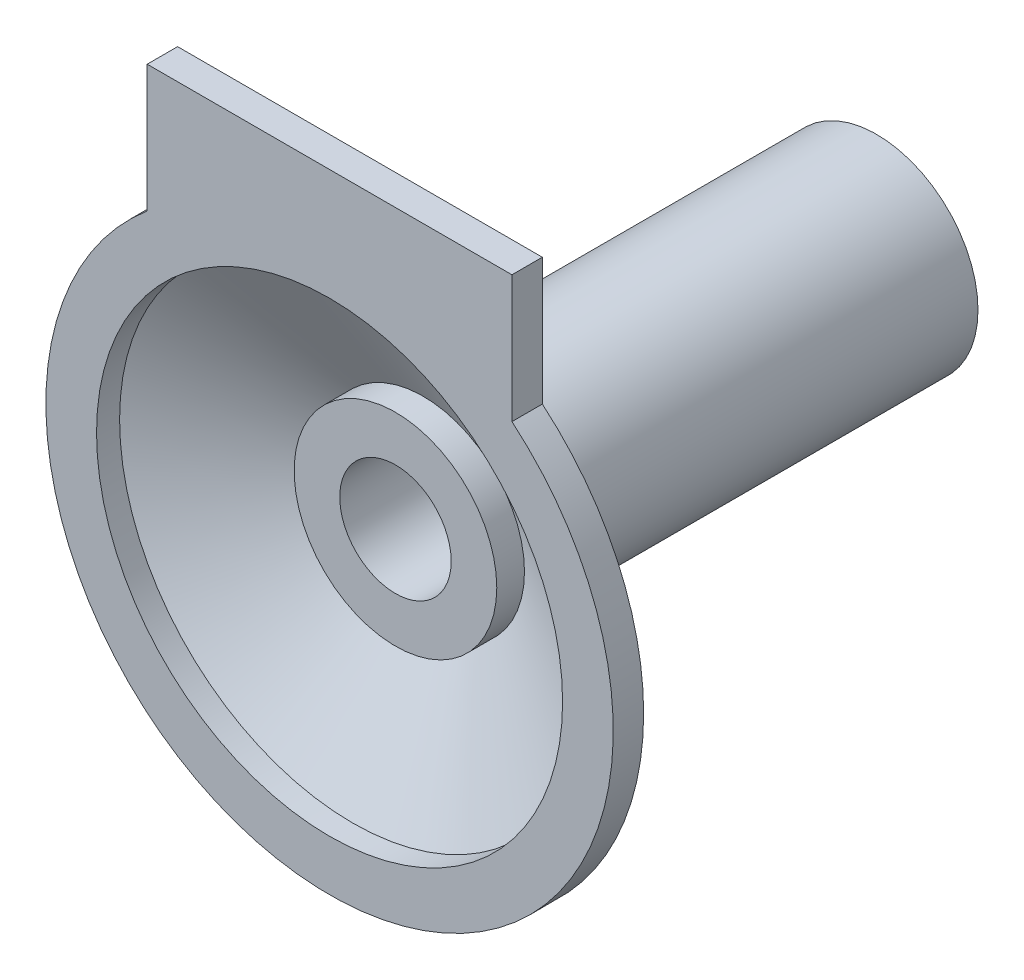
SolidWorks part; units mm, degrees
ref_plane "Front" through (0, 0, 0) normal (0, 0, 1) x (1, 0, 0)
ref_plane "Top" through (0, 0, 0) normal (0, 1, 0) x (1, 0, 0)
ref_plane "Right" through (0, 0, 0) normal (1, 0, 0) x (0, 0, -1)
sketch "Sketch1" plane through (0, 0, 0) normal (1, 0, 0) x (0, 0, -1)
  line L0 (0, 0) -> (89.8884, 0) construction
  line L1 (0, -73.025) -> (0, -88.9)
  line L2 (0, -88.9) -> (9.525, -88.9)
  line L3 (9.525, -88.9) -> (40.1411, -31.75)
  line L4 (40.1411, -31.75) -> (171.45, -31.75)
  line L5 (171.45, -31.75) -> (171.45, -17.4625)
  line L6 (171.45, -17.4625) -> (120.65, -17.4625)
  line L7 (120.65, -17.4625) -> (120.65, -20.6375)
  line L8 (120.65, -20.6375) -> (69.85, -20.6375)
  line L9 (69.85, -20.6375) -> (69.85, -17.4625)
  line L10 (69.85, -17.4625) -> (20.6502, -17.4625)
  line L11 (20.6502, -17.4625) -> (20.6502, -31.75)
  line L12 (20.6502, -31.75) -> (29.3354, -31.75)
  line L13 (29.3354, -31.75) -> (7.2238, -73.025)
  line L14 (7.2238, -73.025) -> (0, -73.025)
  point P5 (57.15, 0)
  dimension "D1" = 34.925
  dimension "D2" = 41.275
  dimension "D3" = 50.8
  dimension "D4" = 50.8
  dimension "D5" = 63.5
  dimension "D6" = 146.05
  dimension "D7" = 177.8
  dimension "D8" = 9.525
  dimension "D9" = 9.525
  dimension "D10" = 20.6502
  dimension "D11" = 171.45
  dimension "D12" = 57.15
revolve "Revolve1" add sketch "Sketch1" angle 360 about L0
sketch "Sketch2" plane through (0, 0, 0) normal (0, 0, 1) x (1, 0, 0)
  line L0 (0, 0) -> (0, 144.1236) construction
  line L1 (-57.15, 68.0962) -> (-26.3735, 68.0962)
  line L2 (-57.15, 68.0962) -> (-57.15, 107.95)
  line L3 (-57.15, 107.95) -> (57.15, 107.95)
  line L4 (57.15, 68.0962) -> (57.15, 107.95)
  line L5 (26.3735, 68.0962) -> (57.15, 68.0962)
  circle A0 centre (0, 0) radius 88.9 construction
  circle A1 centre (0, 0) radius 73.025 construction
  arc A2 (26.3735, 68.0962) -> (-26.3735, 68.0962) centre (0, 0) ccw
  dimension "D1" = 114.3
  dimension "D2" = 107.95
extrude "Extrude1" add sketch "Sketch2" against normal blind 9.525
